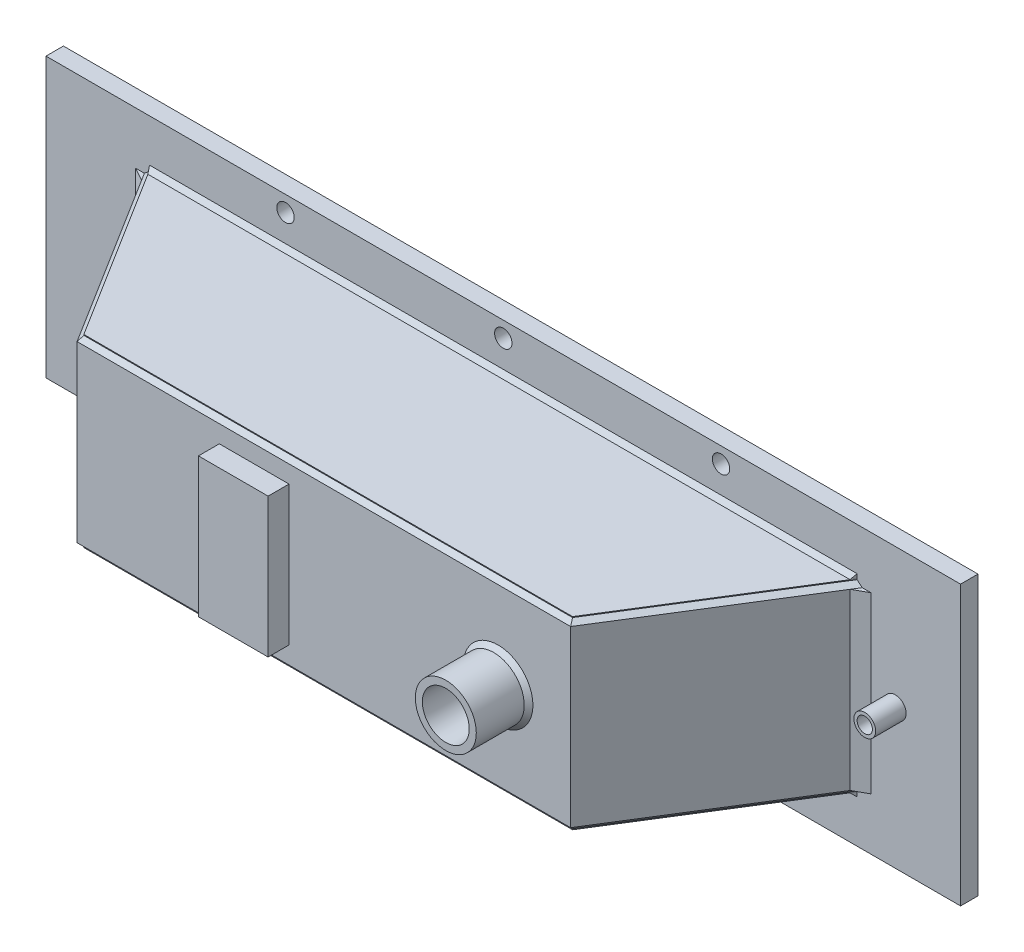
SolidWorks part; units mm, degrees
other "Objet de détail2"
other "Objet de détail3"
other "Objet de détail5"
other "Objet de détail6"
other "Objet de détail8"
other "Objet de détail9"
other "Objet de détail10"
ref_plane "Face" through (0, 0, 0) normal (0, 0, 1) x (1, 0, 0)
ref_plane "Dessus" through (0, 0, 0) normal (0, 1, 0) x (1, 0, 0)
ref_plane "Droite" through (0, 0, 0) normal (1, 0, 0) x (0, 0, -1)
sketch "Esquisse1" plane through (0, 0, 0) normal (0, 0, 1) x (1, 0, 0)
  line L1 (-49.8699, 114.4028) -> (475.1301, 114.4028)
  line L2 (-49.8699, 114.4028) -> (-49.8699, -45.5972)
  line L3 (-49.8699, -45.5972) -> (475.1301, -45.5972)
  line L4 (475.1301, 114.4028) -> (475.1301, -45.5972)
  line L5 (10.1301, 84.4028) -> (415.1301, 84.4028)
  line L6 (10.1301, 84.4028) -> (10.1301, -15.5972)
  line L7 (10.1301, -15.5972) -> (415.1301, -15.5972)
  line L8 (415.1301, 84.4028) -> (415.1301, -15.5972)
  dimension "D1" = 525
  dimension "D2" = 160
  dimension "D3" = 100
  dimension "D4" = 30
  dimension "D5" = 60
  dimension "D6" = 405
extrude "Extrusion1" add sketch "Esquisse1" along normal blind 10
ref_plane "Plan1" through (0, 34.4028, 0) normal (0, -1, 0) x (1, 0, 0)
sketch "Esquisse2" plane through (0, 34.4028, 0) normal (0, -1, 0) x (1, 0, 0)
  line L0 (212.6301, 10) -> (212.6301, 203.1674) construction
  line L1 (-49.8699, 10) -> (475.1301, 10) construction
  line L2 (72.6301, 110) -> (352.6301, 110)
  line L3 (352.6301, 110) -> (415.1301, 10)
  line L4 (72.6301, 110) -> (10.1301, 10)
  line L5 (70.9674, 113) -> (7.5861, 11.59)
  line L6 (70.9674, 113) -> (354.2929, 113)
  line L7 (354.2929, 113) -> (417.6741, 11.59)
  line L8 (7.5861, 11.59) -> (6.5924, 10)
  line L9 (417.6741, 11.59) -> (418.6679, 10)
  line L10 (415.1301, 10) -> (418.6679, 10)
  line L11 (10.1301, 10) -> (6.5924, 10)
  dimension "D1" = 100
  dimension "D2" = 140
  dimension "D3" = 140
  dimension "D4" = 3
extrude "Extrusion2" add sketch "Esquisse2" along normal mid plane 100 separate body
sketch "Esquisse3" plane through (0, -15.5972, 0) normal (0, -1, 0) x (1, 0, 0)
  line L1 (415.5541, 10.265) -> (415.7198, 10)
  line L3 (415.1301, 10) -> (418.6679, 10) construction
  line L5 (415.7198, 10) -> (9.5405, 10)
  line L6 (9.7061, 10.265) -> (72.353, 110.5)
  line L7 (72.353, 110.5) -> (352.9073, 110.5)
  line L8 (352.9073, 110.5) -> (415.5541, 10.265)
  line L9 (-49.8699, 10) -> (475.1301, 10) construction
  line L10 (9.7061, 10.265) -> (9.5405, 10)
  line L11 (6.5924, 10) -> (10.1301, 10) construction
extrude "Extrusion3" add sketch "Esquisse3" along normal blind 3 separate body
sketch "Esquisse4" plane through (0, 84.4028, 0) normal (0, 1, 0) x (-1, 0, 0)
  line L0 (-9.5405, 10) -> (-415.7198, 10)
  line L1 (-9.7061, 10.265) -> (-9.5405, 10)
  line L2 (-475.1301, 10) -> (49.8699, 10) construction
  line L3 (-6.5924, 10) -> (-10.1301, 10) construction
  line L4 (-415.5541, 10.265) -> (-415.7198, 10)
  line L5 (-9.5405, 10) -> (-415.7198, 10) construction
  line L6 (-9.7061, 10.265) -> (-72.353, 110.5)
  line L7 (-72.353, 110.5) -> (-352.9073, 110.5)
  line L8 (-352.9073, 110.5) -> (-415.5541, 10.265)
extrude "Extrusion4" add sketch "Esquisse4" along normal blind 3 separate body
other "Cordon de soudure d'angle2" parameters "D10"=6, "D11"=5, "D12"=0, "D13"=3, "D14"=0
other "Cordon de soudure d'angle3" parameters "D10"=6, "D11"=5, "D12"=0, "D13"=3, "D14"=0
other "Cordon de soudure d'angle5" parameters "D10"=6, "D11"=2.5, "D12"=0, "D13"=3, "D14"=0
other "Cordon de soudure d'angle6" parameters "D10"=6, "D11"=2.5, "D12"=0, "D13"=3, "D14"=0
other "Cordon de soudure d'angle8" parameters "D10"=6, "D11"=2.5, "D12"=0, "D13"=3, "D14"=0
other "Cordon de soudure d'angle9" parameters "D10"=6, "D11"=2.5, "D12"=0, "D13"=3, "D14"=0
ref_plane "Plan2" through (212.6301, 0, 0) normal (1, 0, 0) x (0, 0, -1)
sketch "Esquisse5" plane through (0, 0, 113) normal (0, 0, 1) x (1, 0, 0)
  line L0 (212.6301, -56.65) -> (212.6301, 56.65) construction
  line L1 (152.6301, 74.4028) -> (192.6301, 74.4028)
  line L2 (152.6301, 74.4028) -> (152.6301, -5.5972)
  line L3 (152.6301, -5.5972) -> (192.6301, -5.5972)
  line L4 (192.6301, 74.4028) -> (192.6301, -5.5972)
  line L5 (-125.0876, 34.4028) -> (125.0876, 34.4028) construction
  dimension "D1" = 40
  dimension "D2" = 20
  dimension "D3" = 80
  dimension "D4" = 40
extrude "Extrusion5" add sketch "Esquisse5" along normal blind 12 separate body
sketch "Esquisse6" plane through (0, 0, 113) normal (0, 0, 1) x (1, 0, 0)
  line L0 (-125.0876, 34.4028) -> (125.0876, 34.4028) construction
  line L1 (212.6301, -56.65) -> (212.6301, 56.65) construction
  circle A0 centre (312.6301, 34.4028) radius 15
  dimension "D1" = 30
  dimension "D2" = 100
extrude "Enlèv. mat.-Extru.1" cut sketch "Esquisse6" against normal blind 3
sketch "Esquisse7" plane through (0, 34.4028, 0) normal (0, -1, 0) x (1, 0, 0)
  line L0 (312.6301, 134.6913) -> (312.6301, 98.3224) construction
  line L1 (212.6301, -56.65) -> (212.6301, 56.65) construction
  line L2 (312.6301, 143) -> (330.1301, 143)
  line L3 (330.1301, 143) -> (330.1301, 113)
  line L4 (354.2929, 113) -> (70.9674, 113) construction
  line L5 (330.1301, 113) -> (327.6301, 113)
  line L6 (327.6301, 113) -> (327.6301, 110)
  line L8 (327.6301, 110) -> (312.6301, 110)
  line L9 (312.6301, 143) -> (312.6301, 110)
  dimension "D1" = 100
  dimension "D2" = 35
  dimension "D3" = 3
  dimension "D4" = 15
  dimension "D5" = 30
revolve "Révolution1" add sketch "Esquisse7" angle 360 about L0
hole_wizard "Trou taraudé 3/4 NPT1" positions "Esquisse9" profile "Esquisse8" size "3/4" standard "Ansi Pouces"
sketch "Esquisse9" plane through (0, 0, 143) normal (0, 0, 1) x (1, 0, 0)
  circle A0 centre (312.6301, 34.4028) radius 17.5 construction
  point P0 (312.6301, 34.4028)
sketch "Esquisse8" plane through (312.6301, 34.4028, 143) normal (1, 0, 0) x (0, -1, 0)
  line L0 (0, 0) -> (0, 60.0336)
  line L1 (11.5062, 53.12) -> (0, 60.0336)
  line L2 (-11.5062, 53.12) -> (0, 60.0336) construction
  line L3 (11.5062, 53.12) -> (11.5062, 44.05)
  line L4 (11.5062, 44.05) -> (12.1379, 44.05)
  line L5 (12.1379, 44.05) -> (13.4568, 0)
  line L6 (-12.1379, 44.05) -> (-13.4568, 0) construction
  line L7 (13.4568, 0) -> (0, 0)
  line L8 (0, -6.35) -> (0, 107.95) construction
  line L11 (-11.5062, 44.05) -> (-12.1379, 44.05) construction
  dimension "Diamètre du trou pour taraudage" = 23.0124
  dimension "Profondeur du trou pour taraudage" = 53.12
  dimension "Diamètre du filetage" = 26.9136
  dimension "Angle de filetage" = 3.43
  dimension "Profondeur du filetage" = 44.05
  dimension "Angle de pointe" = 118
other "Cordon de soudure d'angle10" parameters "D10"=6, "D11"=2.5, "D12"=0, "D13"=3, "D14"=0
sketch "Esquisse10" plane through (0, 0, 0) normal (0, 0, -1) x (-1, 0, 0)
  line L0 (-462.6301, 105.4028) -> (37.3699, 105.4028) construction
  line L2 (-125.0876, 34.4028) -> (125.0876, 34.4028) construction
  line L3 (-212.6301, 56.65) -> (-212.6301, -56.65) construction
  circle A0 centre (-337.6301, 105.4028) radius 5
  dimension "D4" = 125
  dimension "D1" = 71
  dimension "D2" = 250
  dimension "D3" = 250
extrude "Enlèv. mat.-Extru.3" cut sketch "Esquisse10" against normal blind 10
pattern_linear "Répétition linéaire1" count 3 spacing 125 along (-1, 0, 0) count 2 spacing 142 along (0, -1, 0) of "Enlèv. mat.-Extru.3"
sketch "Esquisse11" plane through (0, 0, 0) normal (0, 0, -1) x (-1, 0, 0)
  line L0 (-475.1301, 34.4028) -> (-442.959, 34.4028) construction
  line L1 (-475.1301, -45.5972) -> (-475.1301, 114.4028) construction
  line L2 (-212.6301, 56.65) -> (-212.6301, -56.65) construction
  circle A0 centre (-462.6301, 34.4028) radius 5
  dimension "D1" = 250
extrude "Enlèv. mat.-Extru.4" cut sketch "Esquisse11" against normal blind 10
mirror "Symétrie1" about plane through (212.6301, 0, 0) normal (1, 0, 0)
sketch "Esquisse12" plane through (0, 0, 0) normal (0, 0, -1) x (-1, 0, 0)
  line L0 (-475.1301, -45.5972) -> (-475.1301, 114.4028) construction
  line L1 (-475.1301, 114.4028) -> (49.8699, 114.4028) construction
  circle A0 centre (-437.6301, 34.4028) radius 6.25
  dimension "D1" = 12.5
  dimension "D2" = 37.5
  dimension "D3" = 80
extrude "Enlèv. mat.-Extru.5" cut sketch "Esquisse12" against normal blind 10
sketch "Esquisse13" plane through (0, 34.4028, 0) normal (0, -1, 0) x (1, 0, 0)
  line L0 (475.1301, 0) -> (-49.8699, 0) construction
  line L1 (442.0051, 27.5) -> (443.8801, 27.5)
  line L2 (442.0051, 27.5) -> (442.0051, -12.5)
  line L3 (442.0051, -12.5) -> (443.8801, -12.5)
  line L4 (443.8801, 27.5) -> (443.8801, -12.5)
  line L5 (437.6301, 23.7225) -> (437.6301, -13.7775) construction
  line L6 (475.1301, 10) -> (475.1301, 0) construction
  dimension "D1" = 12.5
  dimension "D2" = 40
  dimension "D3" = 37.5
  dimension "D4" = 8.75
  dimension "D5" = 12.5
revolve "Révolution2" add sketch "Esquisse13" angle 360 about L5
